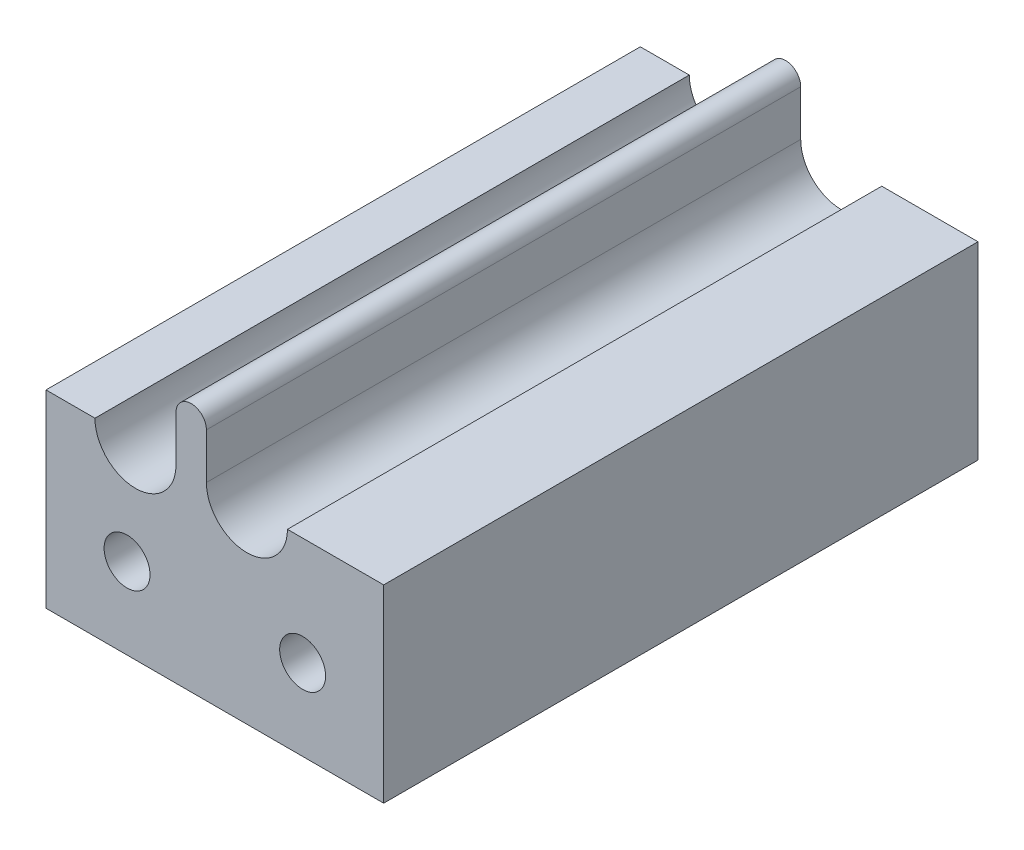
SolidWorks part; units mm, degrees
ref_plane "Frontal" through (0, 0, 0) normal (0, 0, 1) x (1, 0, 0)
ref_plane "Horizontal" through (0, 0, 0) normal (0, 1, 0) x (1, 0, 0)
ref_plane "Profil" through (0, 0, 0) normal (1, 0, 0) x (0, 0, -1)
sketch "Esquisse1" plane through (0, 0, 0) normal (0, 0, 1) x (1, 0, 0)
  line L0 (-299, -176.5) -> (-249, -176.5) construction
  line L1 (-249, -176.5) -> (-249, -148.5) construction
  line L2 (-249, -148.5) -> (-263.25, -148.5) construction
  line L3 (-275.25, -148.5) -> (-279.75, -148.5) construction
  line L4 (-291.75, -148.5) -> (-299, -148.5) construction
  line L5 (-299, -148.5) -> (-299, -176.5) construction
  line L6 (-299, -176.5) -> (-249, -176.5)
  line L7 (-249, -176.5) -> (-249, -148.5)
  line L8 (-249, -148.5) -> (-263.25, -148.5)
  line L9 (-275.25, -148.5) -> (-279.75, -148.5)
  line L10 (-291.75, -148.5) -> (-299, -148.5)
  line L11 (-299, -148.5) -> (-299, -176.5)
  arc A0 (-275.25, -148.5) -> (-263.25, -148.5) centre (-269.25, -148.5) ccw construction
  arc A1 (-291.75, -148.5) -> (-279.75, -148.5) centre (-285.75, -148.5) ccw construction
  arc A2 (-275.25, -148.5) -> (-263.25, -148.5) centre (-269.25, -148.5) ccw
  arc A3 (-291.75, -148.5) -> (-279.75, -148.5) centre (-285.75, -148.5) ccw
extrude "Base-Extrusion" add sketch "Esquisse1" against normal blind 88
hole_wizard "Trou taraudé M8x1.252" positions "Esquisse5" profile "Esquisse4" tap size "M8x1.25" standard "Ansi Métrique"
sketch "Esquisse5" plane through (0, 0, 0) normal (0, 0, 1) x (1, 0, 0)
  line L0 (-249, -176.5) -> (-249, -148.5) construction
  line L1 (-299, -176.5) -> (-249, -176.5) construction
  line L2 (-299, -148.5) -> (-299, -176.5) construction
  point P0 (-261, -164.5)
  point P1 (-287, -164.5)
  dimension "D1" = 12
  dimension "D2" = 12
  dimension "D3" = 12
sketch "Esquisse4" plane through (-261, -164.5, 0) normal (1, 0, 0) x (0, -1, 0)
  line L0 (0, 0) -> (0, 32.0429)
  line L1 (0, 32.0429) -> (3.4, 30)
  line L2 (3.4, 30) -> (3.4, 0)
  line L5 (3.4, 0) -> (0, 0)
  line L10 (0, 32.0429) -> (-3.4, 30) construction
  line L11 (0, -6.35) -> (0, 107.95) construction
  dimension "Diamètre du perçage" = 6.8
  dimension "Profondeur du perçage" = 30
  dimension "Angle de pointe" = 118
sketch "Esquisse6" plane through (0, 0, 0) normal (0, 0, 1) x (1, 0, 0)
  line L1 (-279.75, -148.5) -> (-275.25, -148.5)
  line L2 (-279.75, -148.5) -> (-279.75, -141.75)
  line L4 (-275.25, -148.5) -> (-275.25, -141.75)
  arc A0 (-279.75, -141.75) -> (-275.25, -141.75) centre (-277.5, -141.75) cw
  arc A1 (-275.25, -148.5) -> (-263.25, -148.5) centre (-269.25, -148.5) ccw construction
  dimension "D1" = 2.25
  dimension "D2" = 6.75
extrude "Extrusion2" add sketch "Esquisse6" against normal up to vertex (88 mm away)
